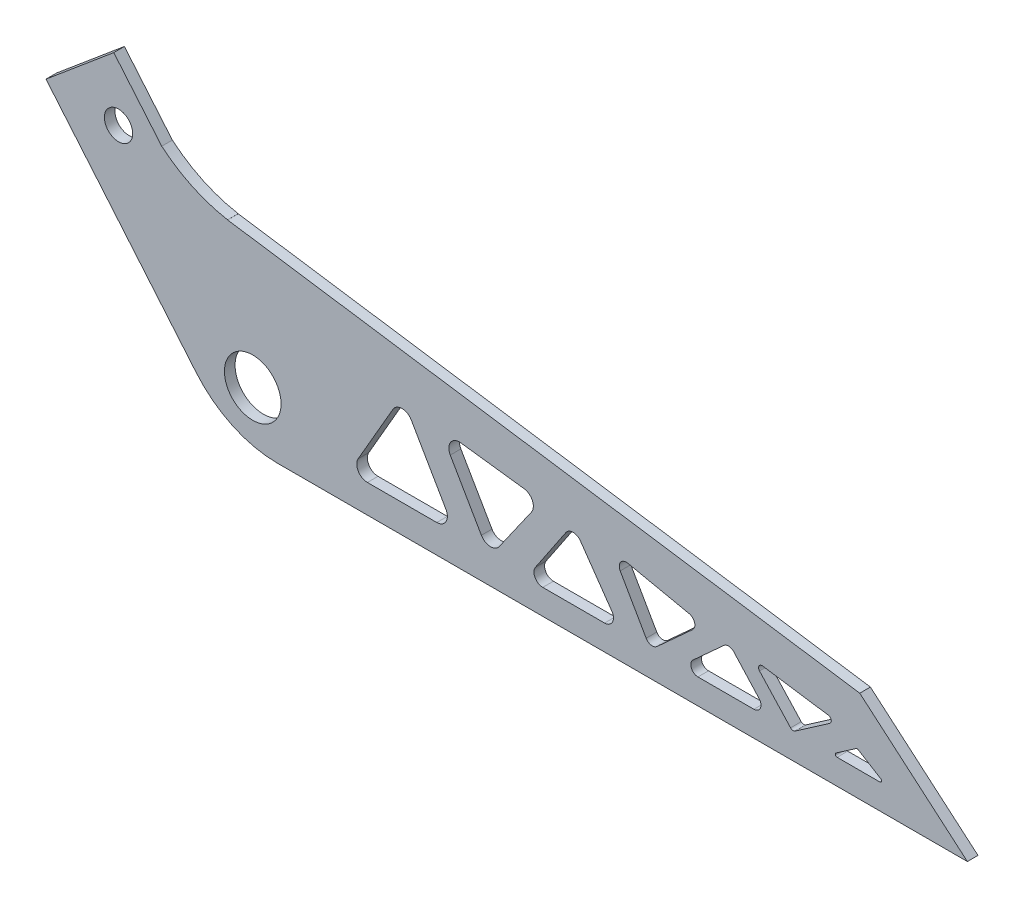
SolidWorks part; units mm, degrees
ref_plane "Front Plane" through (0, 0, 0) normal (0, 0, 1) x (1, 0, 0)
ref_plane "Top Plane" through (0, 0, 0) normal (0, 1, 0) x (1, 0, 0)
ref_plane "Right Plane" through (0, 0, 0) normal (1, 0, 0) x (0, 0, -1)
sketch "Sketch1" plane through (0, 0, 0) normal (0, 0, 1) x (1, 0, 0)
  line L0 (0, 0) -> (19.1511, 16.0697)
  line L1 (19.1511, 16.0697) -> (32.7016, -0.0792)
  line L3 (0, 0) -> (42.4309, -50.5672)
  line L5 (65.4122, -61.2836) -> (260.3234, -61.2836)
  line L7 (11.4907, 9.6418) -> (20.4897, -1.0828) construction
  line L9 (20.4897, -1.0828) -> (28.1501, 5.3451) construction
  line L10 (20.4897, -1.0828) -> (61.4717, -49.9233) construction
  line L11 (20.4897, -1.0828) -> (25.9611, -1.0828) construction
  line L12 (26.4894, -5.0744) -> (131.6515, -133.5602) construction
  line L13 (23.0608, -4.147) -> (53.2719, -40.1511)
  line L14 (19.1511, 16.0697) -> (28.3877, 16.0697)
  line L25 (90.8014, -53.2836) -> (110.4091, -53.2836)
  line L26 (113.0071, -48.7836) -> (103.2033, -31.8028)
  line L27 (98.0071, -31.8028) -> (88.2033, -48.7836)
  line L29 (114.2167, -34.8786) -> (123.0068, -50.1034)
  line L30 (128.0612, -50.3258) -> (137.143, -37.3737)
  line L31 (135.0651, -32.6754) -> (117.1932, -30.4026)
  line L32 (140.3627, -54.1786) -> (157.8257, -54.1786)
  line L33 (159.877, -50.2497) -> (150.9921, -37.4946)
  line L34 (146.8662, -37.5284) -> (138.2882, -50.2835)
  line L36 (162.2271, -39.2083) -> (169.563, -52.0161)
  line L37 (172.6447, -52.5011) -> (182.6743, -43.3725)
  line L38 (181.7426, -39.9368) -> (164.3771, -36.2577)
  line L39 (184.1894, -54.1786) -> (200.0071, -54.1786)
  line L40 (201.4862, -50.8324) -> (194.3195, -42.9584)
  line L41 (191.4942, -42.8256) -> (182.8432, -50.6996)
  line L42 (210.3711, -53.5393) -> (201.5935, -44.0226)
  line L43 (202.4755, -42.3555) -> (221.0139, -45.1091)
  line L44 (221.4365, -46.9202) -> (211.6758, -53.6833)
  line L45 (223.2272, -53.2677) -> (228.8914, -49.343)
  line L46 (229.4371, -49.3275) -> (235.852, -53.2521)
  line L47 (235.5911, -54.1786) -> (223.512, -54.1786)
  line L49 (51.3014, -8.7936) -> (51.305, -8.773)
  line L50 (51.3014, -8.7936) -> (229.9195, -35.2911)
  line L51 (260.3234, -61.2836) -> (229.9195, -35.2911)
  arc A0 (65.4122, -61.2836) -> (42.4309, -50.5672) centre (65.4122, -31.2836) cw
  circle A2 centre (20.4897, -1.0828) radius 4
  circle A3 centre (58.4142, -46.2794) radius 8
  arc A4 (110.4091, -53.2836) -> (113.0071, -48.7836) centre (110.4091, -50.2836) ccw
  arc A5 (90.8014, -53.2836) -> (88.2033, -48.7836) centre (90.8014, -50.2836) cw
  arc A6 (98.0071, -31.8028) -> (103.2033, -31.8028) centre (100.6052, -33.3028) cw
  arc A7 (123.0068, -50.1034) -> (128.0612, -50.3258) centre (125.6048, -48.6034) ccw
  arc A8 (137.143, -37.3737) -> (135.0651, -32.6754) centre (134.6866, -35.6514) ccw
  arc A9 (114.2167, -34.8786) -> (117.1932, -30.4026) centre (116.8148, -33.3786) cw
  arc A10 (157.8257, -54.1786) -> (159.877, -50.2497) centre (157.8257, -51.6786) ccw
  arc A11 (138.2882, -50.2835) -> (140.3627, -54.1786) centre (140.3627, -51.6786) ccw
  arc A12 (146.8662, -37.5284) -> (150.9921, -37.4946) centre (148.9407, -38.9235) cw
  arc A13 (182.6743, -43.3725) -> (181.7426, -39.9368) centre (181.3281, -41.8934) ccw
  arc A14 (172.6447, -52.5011) -> (169.563, -52.0161) centre (171.2985, -51.0221) cw
  arc A15 (162.2271, -39.2083) -> (164.3771, -36.2577) centre (163.9626, -38.2143) cw
  arc A16 (184.1894, -54.1786) -> (182.8432, -50.6996) centre (184.1894, -52.1786) cw
  arc A17 (200.0071, -54.1786) -> (201.4862, -50.8324) centre (200.0071, -52.1786) ccw
  arc A18 (194.3195, -42.9584) -> (191.4942, -42.8256) centre (192.8404, -44.3047) ccw
  arc A19 (221.4365, -46.9202) -> (221.0139, -45.1091) centre (220.8669, -46.0982) ccw
  arc A20 (210.3711, -53.5393) -> (211.6758, -53.6833) centre (211.1062, -52.8613) ccw
  arc A21 (201.5935, -44.0226) -> (202.4755, -42.3555) centre (202.3286, -43.3446) cw
  arc A22 (223.512, -54.1786) -> (223.2272, -53.2677) centre (223.512, -53.6786) cw
  arc A23 (235.5911, -54.1786) -> (235.852, -53.2521) centre (235.5911, -53.6786) ccw
  arc A24 (229.4371, -49.3275) -> (228.8914, -49.343) centre (229.1761, -49.754) ccw
  arc A25 (51.305, -8.773) -> (32.7016, -0.0792) centre (58.1723, 30.1732) cw
  point P12 (51.423, -61.2836)
  point P15 (39.7203, -8.4437)
  point P55 (100.6052, -27.3028)
  point P58 (125.3596, -54.1786)
  point P73 (170.8017, -54.1786)
  point P93 (229.4371, -38.2143)
  point P96 (243.3061, -39.9368)
  point P98 (234.3244, -38.2143)
  point P99 (0, 0)
  point P100 (0, 0)
  point P101 (0, 0)
  point P102 (0, 0)
  point P103 (0, 0)
  point P104 (0, 0)
  point P105 (0, 0)
  point P106 (229.4371, -36.2577)
  point P108 (229.4371, -35.6514)
  dimension "D9" = 30
  dimension "D12" = 50
  dimension "D14" = 16
  dimension "D16" = 8
  dimension "D20" = 3
  dimension "D21" = 3
  dimension "D22" = 2.5
  dimension "D23" = 2
  dimension "D24" = 2
  dimension "D25" = 1
  dimension "D26" = 0.5
  dimension "D1" = 25
  dimension "D2" = 32
  dimension "D4" = 80
  dimension "D6" = 50
  dimension "D10" = 10
  dimension "D11" = 10
  dimension "D13" = 47
  dimension "D15" = 14
  dimension "D17" = 8
  dimension "D19" = 8
extrude "Boss-Extrude1" add sketch "Sketch1" along normal blind 3
